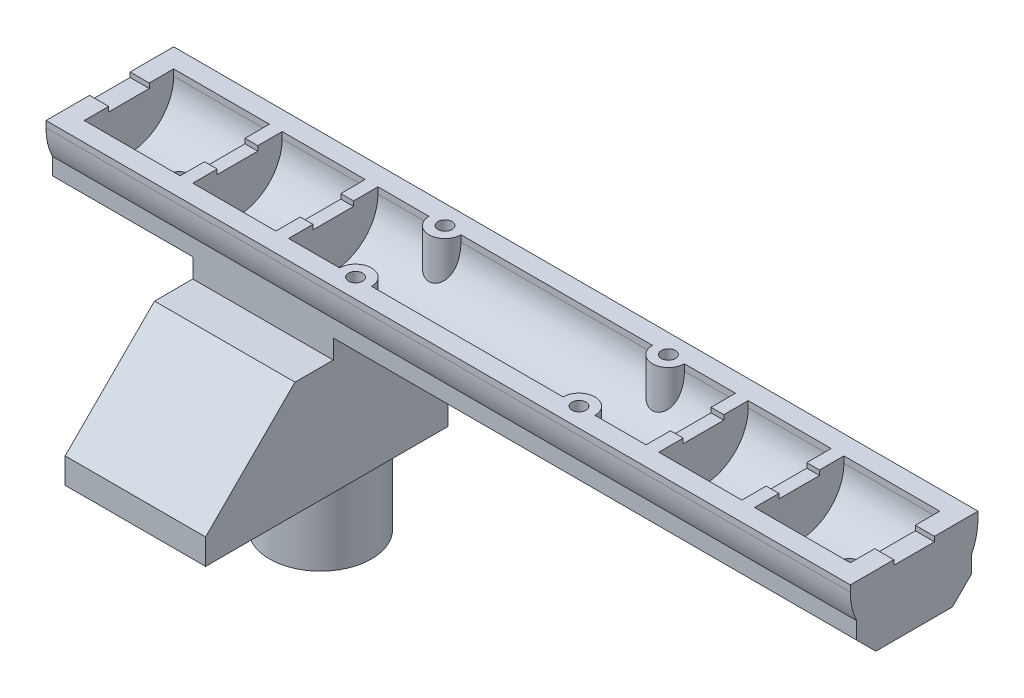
SolidWorks part; units mm, degrees
ref_plane "Front Plane" through (0, 0, 0) normal (0, 0, 1) x (1, 0, 0)
ref_plane "Top Plane" through (0, 0, 0) normal (0, 1, 0) x (1, 0, 0)
ref_plane "Right Plane" through (0, 0, 0) normal (1, 0, 0) x (0, 0, -1)
ref_plane "Plane1" through (60, 0, 0) normal (1, 0, 0) x (0, 0, -1)
sketch "Sketch1" plane through (0, 0, 0) normal (1, 0, 0) x (0, 0, -1)
  line L0 (-10, 0) -> (10, 0) construction
  line L1 (-10, 0) -> (-7, 0)
  line L2 (0, 0) -> (0, -10) construction
  line L3 (10, 0) -> (7, 0)
  line L4 (10, 0) -> (7, 0)
  line L5 (9, -4.3589) -> (9, -28)
  line L6 (9, -28) -> (-9, -28)
  line L7 (-9, -28) -> (-9, -4.3589)
  arc A0 (-10, 0) -> (10, 0) centre (0, 0) ccw
  arc A1 (-7, 0) -> (7, 0) centre (0, 0) ccw
  arc A2 (9, -4.3589) -> (-9, -4.3589) centre (0, 0) cw
  dimension "D1" = 10
  dimension "D2" = 3
  dimension "D3" = 18
  dimension "D4" = 28
extrude "Boss-Extrude1" add sketch "Sketch1" along normal blind 120 contours A1 L1 A0 L3 | A0 L7 L6 L5
sketch "Sketch3" plane through (0, -28, 0) normal (0, -1, 0) x (1, 0, 0)
  line L0 (0, 0) -> (120, 0) construction
  line L1 (0, -9) -> (0, 9) construction
  line L2 (120, -9) -> (120, 9) construction
  circle A0 centre (30, 0) radius 7.99
  point P6 (30, 0)
  dimension "D2" = 15.98
  dimension "D1" = 30
extrude "Boss-Extrude2" add sketch "Sketch3" along normal blind 15
sketch "Sketch2" plane through (120, 0, 0) normal (1, 0, 0) x (0, 0, -1)
  line L0 (-10, 0) -> (10, 0)
  line L1 (10, 0) -> (7, 0) construction
  line L2 (-9, -4.3589) -> (-9, -28)
  line L3 (-9, -28) -> (9, -28)
  line L4 (9, -28) -> (9, -4.3589)
  arc A0 (-10, 0) -> (-9, -4.3589) centre (0, 0) ccw construction
  arc A1 (-10, 0) -> (10, 0) centre (0, 0) ccw
  arc A2 (-9, -4.3589) -> (9, -4.3589) centre (0, 0) ccw
extrude "Boss-Extrude3" add sketch "Sketch2" along normal blind 3 contours A1 M7 M8 M9 | A1 M3 M10 M4 M1 M2 | L0 M1
mirror "Mirror1" about plane through (60, 0, 0) normal (1, 0, 0) of "Boss-Extrude3"
sketch "Sketch4" plane through (0, 0, 0) normal (0, 1, 0) x (1, 0, 0)
  line L0 (-3, 10) -> (-3, -10)
  line L1 (-3, -10) -> (123, -10)
  line L2 (123, -10) -> (123, 10)
  line L3 (123, 10) -> (-3, 10)
  line L4 (0, 7) -> (0, -7)
  line L5 (0, -7) -> (120, -7)
  line L6 (120, 7) -> (120, -7) construction
  line L7 (120, -7) -> (0, -7) construction
  line L8 (120, -7) -> (120, 7)
  line L9 (120, 7) -> (0, 7)
extrude "Boss-Extrude4" add sketch "Sketch4" along normal blind 1
ref_plane "Plane2" through (15, 0, 0) normal (1, 0, 0) x (0, 0, -1)
sketch "Sketch6" plane through (15, 0, 0) normal (1, 0, 0) x (0, 0, -1)
  line L0 (9, 1) -> (-9, 1) construction
  line L2 (9, 1) -> (9, 0)
  line L3 (-9, 1) -> (-9, 0)
  line L4 (10, 1) -> (-10, 1) construction
  line L5 (9, 1) -> (3.175, 1)
  line L6 (3.175, 1) -> (3.175, 0.25)
  line L7 (3.175, 0.25) -> (-3.175, 0.25)
  line L8 (-3.175, 0.25) -> (-3.175, 1)
  line L9 (-3.175, 1) -> (-9, 1)
  line L10 (0, 1) -> (0, -9) construction
  arc A0 (9, 0) -> (-9, 0) centre (0, 0) cw
  dimension "D1" = 1
  dimension "D2" = 1
  dimension "D3" = 1
  dimension "D4" = 6.35
  dimension "D5" = 0.75
sketch "Sketch7" plane through (0, -28, 0) normal (0, -1, 0) x (1, 0, 0)
  line L0 (123, 0) -> (-3, 0) construction
  line L1 (123, 9) -> (123, -9) construction
  line L2 (-3, 9) -> (-3, -9) construction
  circle A0 centre (112.5, 0) radius 1.7
  point P6 (112.5, 0)
  dimension "D2" = 3.4
  dimension "D1" = 10.5
extrude "Cut-Extrude3" cut sketch "Sketch7" against normal through all
pattern_linear "LPattern2" count 2 spacing 30 along (-1, 0, 0) of "Cut-Extrude3"
sketch "Sketch8" plane through (0, -28, 0) normal (0, -1, 0) x (1, 0, 0)
  line L0 (-3, 0) -> (123, 0) construction
  line L1 (-3, 9) -> (-3, -9) construction
  line L2 (123, 9) -> (123, -9) construction
  circle A0 centre (7.5, 0) radius 1.7
  point P6 (7.5, 0)
  dimension "D2" = 3.4
  dimension "D1" = 10.5
extrude "Cut-Extrude4" cut sketch "Sketch8" against normal through all
extrude "Boss-Extrude5" add sketch "Sketch6" along normal blind 2
pattern_linear "LPattern4" count 2 spacing 15 along (1, 0, 0) of "Boss-Extrude5"
mirror "Mirror3" about plane through (60, 0, 0) normal (1, 0, 0) of "LPattern4", "Boss-Extrude5"
sketch "Sketch9" plane through (123, 0, 0) normal (1, 0, 0) x (0, 0, -1)
  line L0 (-3.175, 1) -> (-3.175, 0.25)
  line L1 (-10, 1) -> (10, 1) construction
  line L2 (-3.175, 0.25) -> (3.175, 0.25)
  line L3 (3.175, 0.25) -> (3.175, 1)
  line L4 (3.175, 1) -> (-3.175, 1)
  line L5 (0, 0.25) -> (0, 1) construction
  dimension "D1" = 6.35
  dimension "D2" = 0.75
extrude "Cut-Extrude5" cut sketch "Sketch9" against normal up to next
mirror "Mirror4" about plane through (60, 0, 0) normal (1, 0, 0) of "Cut-Extrude5"
sketch "Sketch10" plane through (0, 0, 9) normal (0, 0, 1) x (1, 0, 0)
  line L0 (123, -28) -> (-3, -28) construction
  line L1 (41, -28) -> (123, -28)
  line L2 (41, -28) -> (41, -10)
  line L3 (41, -10) -> (123, -10)
  line L4 (123, -28) -> (123, -10)
  line L5 (123, -4.3589) -> (123, -28) construction
  line L6 (-3, -4.3589) -> (-3, -28) construction
  line L7 (-3, -10) -> (19, -10)
  line L8 (-3, -10) -> (-3, -28)
  line L9 (-3, -28) -> (19, -28)
  line L10 (19, -10) -> (19, -28)
  line L11 (30, -28) -> (30, -4.3589) construction
  line L12 (123, -4.3589) -> (-3, -4.3589) construction
  line L13 (30, -43) -> (30, -28) construction
  dimension "D1" = 22
  dimension "D2" = 18
extrude "Cut-Extrude6" cut sketch "Sketch10" against normal through all
sketch "Sketch11" plane through (0, 1, 0) normal (0, 1, 0) x (1, 0, 0)
  line L0 (32, -7) -> (88, -7) construction
  line L1 (45, -7) -> (40, -7)
  arc A0 (40, -7) -> (45, -7) centre (42.5, -7) cw
  dimension "D1" = 2.5
  dimension "D2" = 10.5
extrude "Boss-Extrude6" add sketch "Sketch11" against normal up to surface (1 mm away)
sketch "Sketch12" plane through (0, 1, 0) normal (0, 1, 0) x (1, 0, 0)
  circle A0 centre (42.5, -7) radius 1.1
  dimension "D1" = 2.2
extrude "Cut-Extrude7" cut sketch "Sketch12" against normal blind 1.7
mirror "Mirror5" about plane through (0, 0, 0) normal (0, 0, 1) of "Cut-Extrude7", "Boss-Extrude6"
pattern_linear "LPattern5" count 2 spacing 35 along (1, 0, 0) of "Boss-Extrude6", "Cut-Extrude7", "Mirror5"
chamfer "Chamfer1" distance 3 angle 45 4 edges at (82, -10, -9) (8, -10, -9) (82, -10, 9) (8, -10, 9)
sketch "Sketch13" plane through (0, 0, 9) normal (0, 0, 1) x (1, 0, 0)
  line L0 (41, -7) -> (41, -28) construction
  line L1 (19, -28) -> (41, -28)
  line L2 (19, -28) -> (19, -10)
  line L3 (19, -10) -> (41, -10)
  line L4 (41, -28) -> (41, -10)
  line L5 (19, -10) -> (-3, -10) construction
extrude "Boss-Extrude7" add sketch "Sketch13" along normal blind 20
chamfer "Chamfer2" distance 14 angle 45 1 edges at (30, -10, 29)
